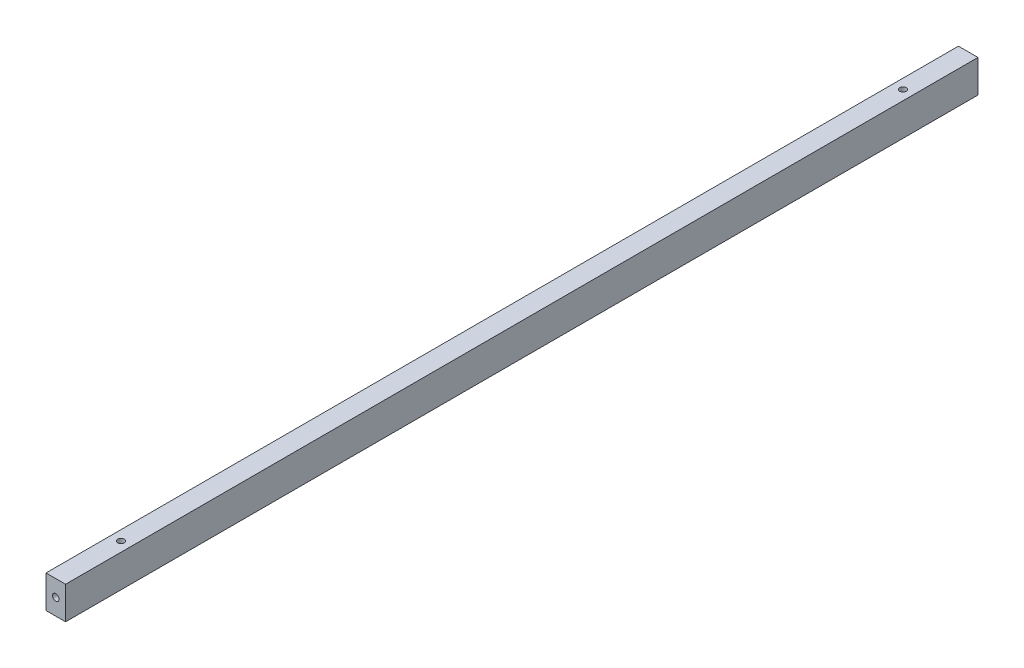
SolidWorks part; units mm, degrees
ref_plane "Plan de face" through (0, 0, 0) normal (0, 0, 1) x (1, 0, 0)
ref_plane "Plan de dessus" through (0, 0, 0) normal (0, 1, 0) x (1, 0, 0)
ref_plane "Plan de droite" through (0, 0, 0) normal (1, 0, 0) x (0, 0, -1)
sketch "Esquisse1" plane through (0, 0, 0) normal (0, 0, 1) x (1, 0, 0)
  line L0 (-7.5, -12.5) -> (7.5, 12.5) construction
  line L1 (-7.5, -12.5) -> (7.5, -12.5)
  line L2 (-7.5, -12.5) -> (-7.5, 12.5)
  line L3 (-7.5, 12.5) -> (7.5, 12.5)
  line L4 (7.5, -12.5) -> (7.5, 12.5)
  point P4 (0, 0)
  dimension "D1" = 15
  dimension "D2" = 25
extrude "Extrusion1" add sketch "Esquisse1" along normal mid plane 700
hole_wizard "Trou taraudé M6x1.01" positions "Esquisse3" profile "Esquisse2" tap size "M6x1.0" standard "ISO"
sketch "Esquisse3" plane through (0, 0, 350) normal (0, 0, 1) x (1, 0, 0)
  point P0 (0, 0)
sketch "Esquisse2" plane through (0, 0, 350) normal (1, 0, 0) x (0, -1, 0)
  line L0 (0, 0) -> (0, 21.5022)
  line L1 (0, 21.5022) -> (2.5, 20)
  line L2 (2.5, 20) -> (2.5, 0)
  line L5 (2.5, 0) -> (0, 0)
  line L10 (0, 21.5022) -> (-2.5, 20) construction
  line L11 (0, -6.35) -> (0, 107.95) construction
  dimension "Diamètre du trou pour taraudage" = 5
  dimension "Profondeur du trou pour taraudage" = 20
  dimension "Angle de pointe" = 118
hole_wizard "Trou taraudé M6x1.02" positions "Esquisse5" profile "Esquisse4" tap size "M6x1.0" standard "ISO"
sketch "Esquisse5" plane through (0, 0, -350) normal (0, 0, -1) x (-1, 0, 0)
  point P0 (0, 0)
sketch "Esquisse4" plane through (0, 0, -350) normal (1, 0, 0) x (0, 1, 0)
  line L0 (0, 0) -> (0, 21.5022)
  line L1 (0, 21.5022) -> (2.5, 20)
  line L2 (2.5, 20) -> (2.5, 0)
  line L5 (2.5, 0) -> (0, 0)
  line L10 (0, 21.5022) -> (-2.5, 20) construction
  line L11 (0, -6.35) -> (0, 107.95) construction
  dimension "Diamètre du trou pour taraudage" = 5
  dimension "Profondeur du trou pour taraudage" = 20
  dimension "Angle de pointe" = 118
hole_wizard "Trou taraudé M6x1.03" positions "Esquisse7" profile "Esquisse6" tap size "M6x1.0" standard "ISO"
sketch "Esquisse7" plane through (0, 12.5, 0) normal (0, 1, 0) x (-1, 0, 0)
  line L0 (-7.5, -350) -> (7.5, -350) construction
  line L1 (-7.5, 350) -> (-7.5, -350) construction
  point P0 (0, 300)
  point P1 (0, -300)
  dimension "D1" = 50
  dimension "D2" = 600
  dimension "D3" = 7.5
sketch "Esquisse6" plane through (0, 12.5, 300) normal (1, 0, 0) x (0, 0, 1)
  line L0 (0, 0) -> (0, 25)
  line L1 (0, 25) -> (2.5, 25)
  line L2 (2.5, 25) -> (2.5, 0)
  line L5 (2.5, 0) -> (0, 0)
  line L11 (0, -6.35) -> (0, 107.95) construction
  dimension "Diamètre du trou pour taraudage jusqu'au prochain" = 5
  dimension "Profondeur du trou pour taraudage jusqu'au prochain" = 25
